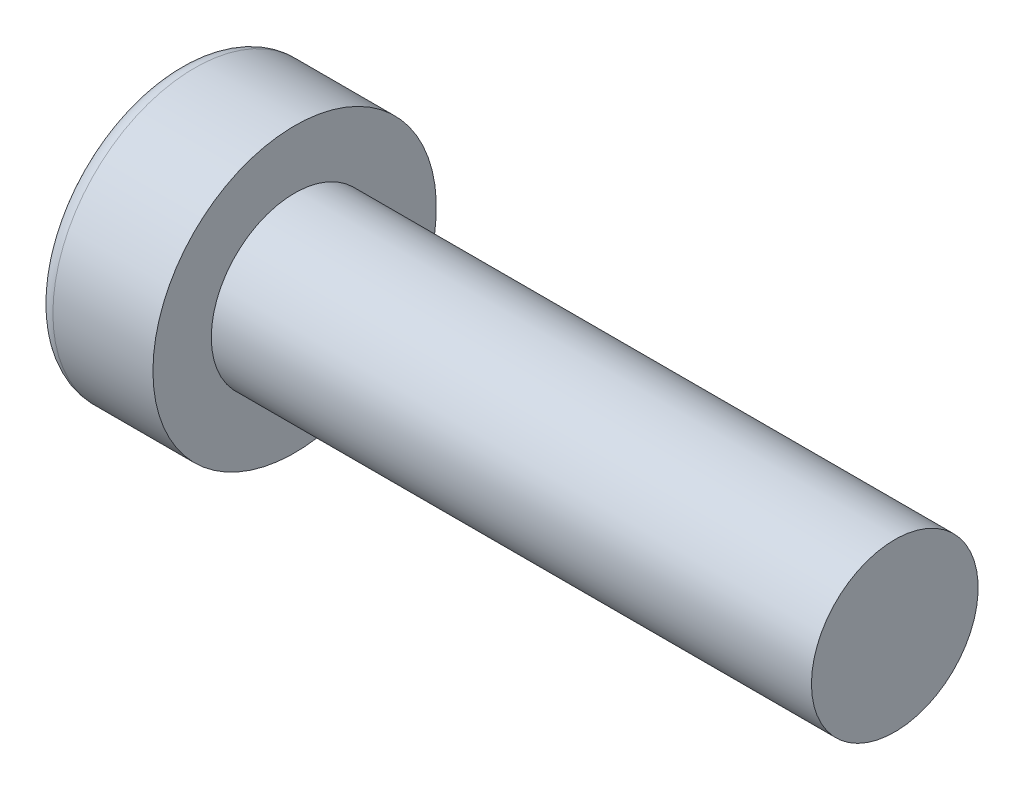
SolidWorks part; units mm, degrees
ref_plane "Ebene vorne" through (0, 0, 0) normal (0, 0, 1) x (1, 0, 0)
ref_plane "Ebene oben" through (0, 0, 0) normal (0, 1, 0) x (1, 0, 0)
ref_plane "Ebene rechts" through (0, 0, 0) normal (1, 0, 0) x (0, 0, -1)
sketch "Skizze1" plane through (0, 0, 0) normal (0, 0, 1) x (1, 0, 0)
  line L0 (-65.0118, 0) -> (64.6036, 0) construction
  line L1 (-21.5, 0) -> (-21.5, 4.25)
  line L2 (-21.5, 4.25) -> (-18, 4.25)
  line L3 (-18, 4.25) -> (-18, 2.5)
  line L4 (-18, 2.5) -> (0, 2.5)
  line L5 (0, 2.5) -> (0, 0)
  line L6 (0, 0) -> (-21.5, 0)
  dimension "D1" = 5
  dimension "D2" = 18
  dimension "D3" = 8.5
  dimension "D4" = 3.5
revolve "Rotation1" add sketch "Skizze1" angle 360 about L0
fillet "Verrundung1" radius 0.5 1 edges at (-21.5, 0, 4.25)
sketch "Skizze2" plane through (-21.5, 0, 0) normal (-1, 0, 0) x (0, 0, 1)
  line L1 (2, 1.1547) -> (0, 2.3094)
  line L2 (0, 2.3094) -> (-2, 1.1547)
  line L3 (-2, 1.1547) -> (-2, -1.1547)
  line L4 (-2, -1.1547) -> (0, -2.3094)
  line L5 (0, -2.3094) -> (2, -1.1547)
  line L6 (2, -1.1547) -> (2, 1.1547)
  circle A0 centre (0, 0) radius 2 construction
  dimension "D1" = 4
extrude "Schnitt-Linear austragen1" cut sketch "Skizze2" against normal blind 3
